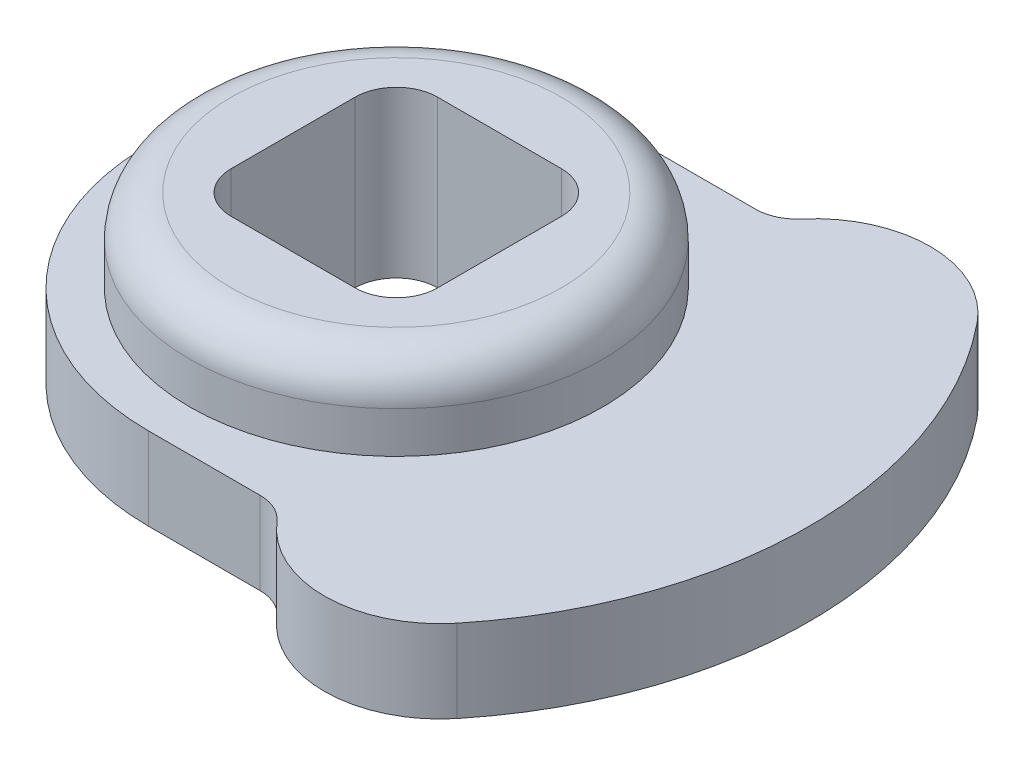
SolidWorks part; units mm, degrees
ref_plane "Front Plane" through (0, 0, 0) normal (0, 0, 1) x (1, 0, 0)
ref_plane "Top Plane" through (0, 0, 0) normal (0, 1, 0) x (1, 0, 0)
ref_plane "Right Plane" through (0, 0, 0) normal (1, 0, 0) x (0, 0, -1)
sketch "Sketch1" plane through (0, 0, 0) normal (0, 1, 0) x (1, 0, 0)
  circle A0 centre (0, 0) radius 6.35
  dimension "D1" = 12.7
extrude "Boss-Extrude1" add sketch "Sketch1" along normal blind 5.08
sketch "Sketch2" plane through (0, 0, 0) normal (0, 1, 0) x (1, 0, 0)
  line L0 (0, 0) -> (11.4224, 0) construction
  line L1 (0, 7.62) -> (3.429, 7.62)
  line L2 (0, -7.62) -> (3.429, -7.62)
  arc A1 (3.429, 7.62) -> (4.3956, 8.0662) centre (3.429, 8.89) ccw
  circle A2 centre (0, 0) radius 7.62
  arc A3 (0, 7.62) -> (0, -7.62) centre (0, 0) ccw
  arc A4 (4.3956, 8.0662) -> (9.864, 7.9995) centre (7.102, 5.7597) cw
  arc A5 (4.3956, -8.0662) -> (9.864, -7.9995) centre (7.102, -5.7597) ccw
  arc A6 (3.429, -7.62) -> (4.3956, -8.0662) centre (3.429, -8.89) cw
  arc A7 (9.864, -7.9995) -> (9.864, 7.9995) centre (0, 0) ccw
  dimension "D2" = 1.27
  dimension "D3" = 3.556
  dimension "D5" = 12.7
  dimension "D4" = 3.429
  dimension "D1" = 1.27
extrude "Boss-Extrude2" add sketch "Sketch2" along normal blind 2.54
sketch "Sketch4" plane through (0, 5.08, 0) normal (0, 1, 0) x (1, 0, 0)
  line L1 (-1.905, -3.175) -> (1.905, -3.175)
  line L2 (-3.175, -1.905) -> (-3.175, 1.905)
  line L3 (-1.905, 3.175) -> (1.905, 3.175)
  line L4 (3.175, -1.905) -> (3.175, 1.905)
  line L5 (-3.175, -3.175) -> (3.175, 3.175) construction
  line L6 (-3.175, 3.175) -> (3.175, -3.175) construction
  arc A0 (-1.905, -3.175) -> (-3.175, -1.905) centre (-1.905, -1.905) cw
  arc A1 (1.905, -3.175) -> (3.175, -1.905) centre (1.905, -1.905) ccw
  arc A2 (1.905, 3.175) -> (3.175, 1.905) centre (1.905, 1.905) cw
  arc A3 (-3.175, 1.905) -> (-1.905, 3.175) centre (-1.905, 1.905) cw
  point P0 (0, 0)
  dimension "D3" = 1.27
  dimension "D1" = 6.35
  dimension "D2" = 6.35
extrude "Cut-Extrude1" cut sketch "Sketch4" against normal through all
fillet "Fillet1" radius 1.27 1 edges at (0, 5.08, 6.35)
